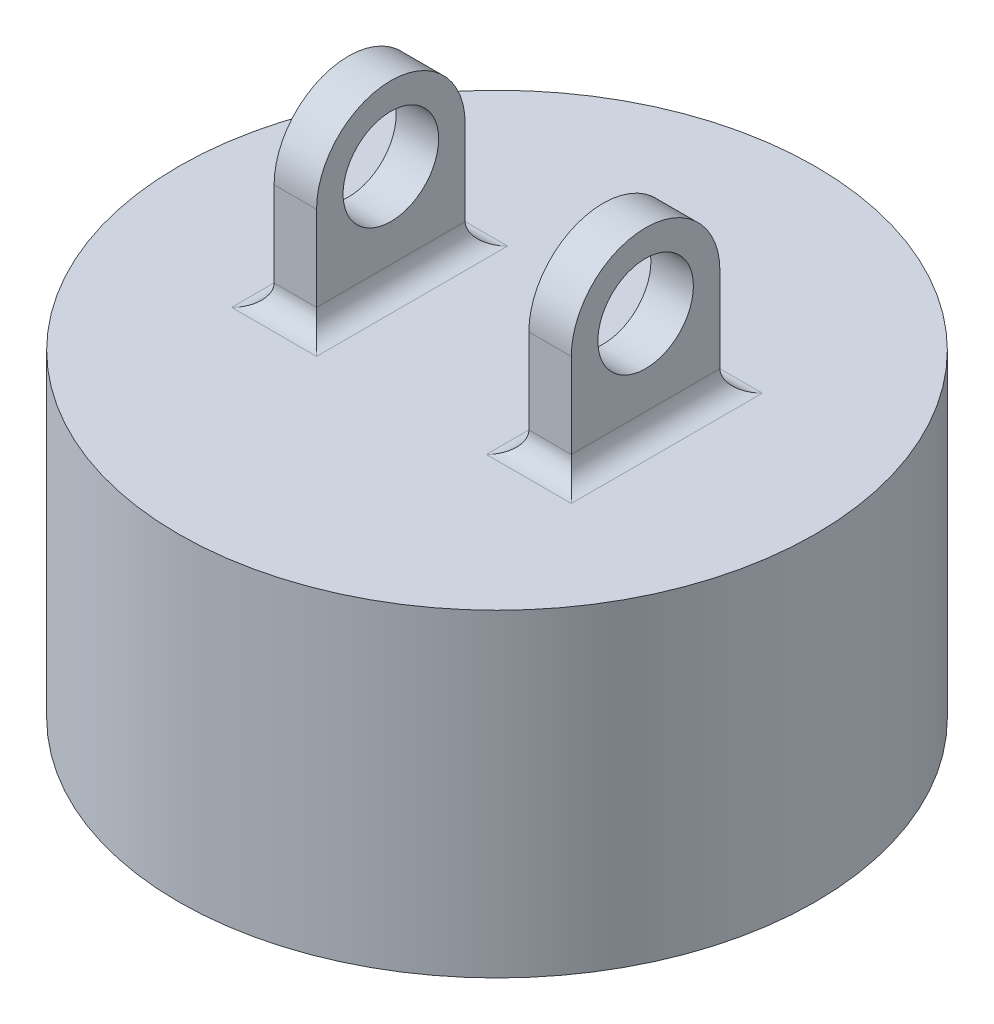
SolidWorks part; units mm, degrees
ref_plane "Front Plane" through (0, 0, 0) normal (0, 0, 1) x (1, 0, 0)
ref_plane "Top Plane" through (0, 0, 0) normal (0, 1, 0) x (1, 0, 0)
ref_plane "Right Plane" through (0, 0, 0) normal (1, 0, 0) x (0, 0, -1)
sketch "Sketch1" plane through (0, 0, 0) normal (0, 1, 0) x (1, 0, 0)
  circle A0 centre (0, 0) radius 150
  dimension "D1" = 300
extrude "Boss-Extrude1" add sketch "Sketch1" along normal blind 150 contours A0
sketch "Sketch2" plane through (0, 0, 0) normal (0, -1, 0) x (1, 0, 0)
  circle A0 centre (0, 0) radius 75
  dimension "D1" = 150
extrude "Cut-Extrude1" cut sketch "Sketch2" against normal blind 100
ref_plane "Plane1" through (50, 0, 0) normal (1, 0, 0) x (0, 0, -1)
sketch "Sketch3" plane through (50, 0, 0) normal (1, 0, 0) x (0, 0, -1)
  line L0 (-35, 150) -> (-35, 200)
  line L1 (35, 200) -> (35, 150)
  line L2 (35, 150) -> (-35, 150)
  line L3 (150, 150) -> (-150, 150) construction
  arc A0 (-35, 200) -> (35, 200) centre (0, 200) cw
  circle A1 centre (0, 200) radius 22.5
  point P4 (0, 150)
  dimension "D3" = 45
  dimension "D1" = 50
  dimension "D2" = 70
extrude "Boss-Extrude3" add sketch "Sketch3" along normal blind 20
mirror "Mirror1" about plane through (0, 0, 0) normal (1, 0, 0) of "Boss-Extrude3"
fillet "Fillet1" radius 10 8 edges at (60, 150, 35) (50, 150, 0) (70, 150, 0) (60, 150, -35) (-60, 150, -35) (-70, 150, 0) (-50, 150, 0) (-60, 150, 35)
